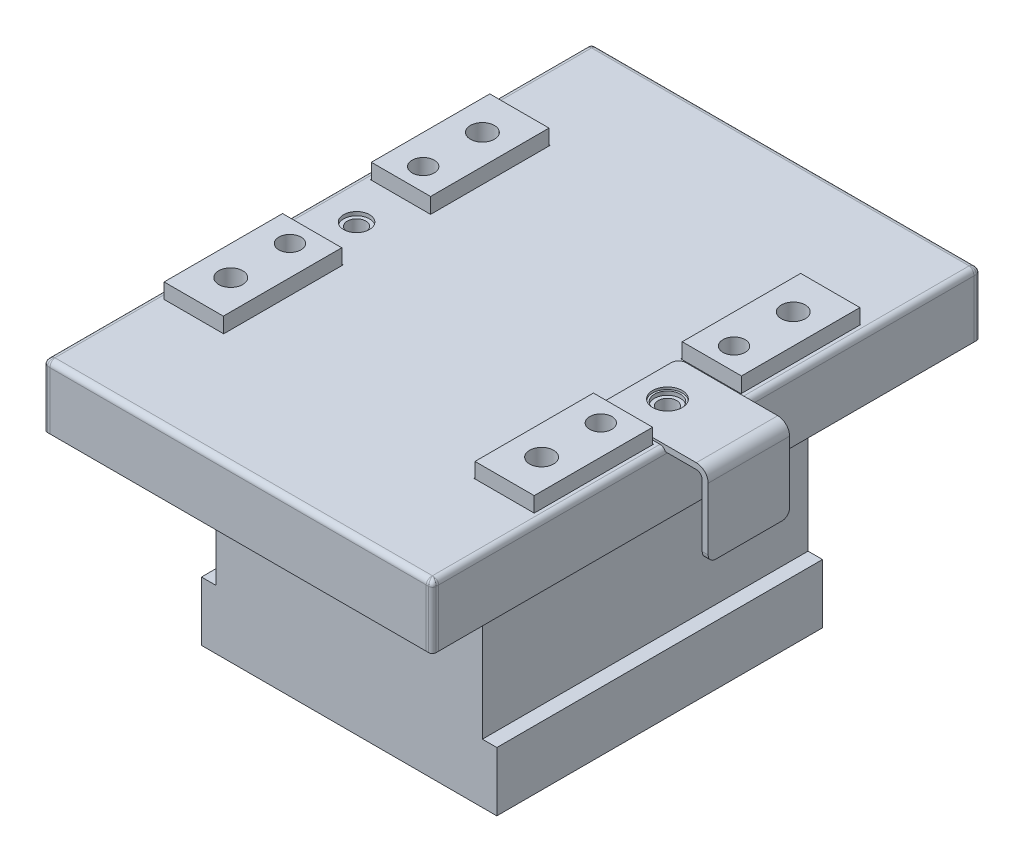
SolidWorks part; units mm, degrees
other "<上盖YTH5>-<焊接的边角7>"
ref_plane "前视" through (0, 0, 0) normal (0, 0, 1) x (1, 0, 0)
ref_plane "上视" through (0, 0, 0) normal (0, 1, 0) x (1, 0, 0)
ref_plane "右视" through (0, 0, 0) normal (1, 0, 0) x (0, 0, -1)
imported_body "输入1"
ref_plane "基准面1" through (-16.8713, 0, 0) normal (-1, 0, 0) x (0, 0, 1)
ref_plane "基准面2" through (0, 0, 46) normal (0, 0, 1) x (1, 0, 0)
hole_wizard "大小mm 暗销孔0" positions "草图2" profile "草图1" hole size "Ø3.0" standard "Gb"
sketch "草图2" plane through (0, 40.7273, 0) normal (0, 1, 0) x (1, 0, 0)
  circle A0 centre (4.1287, -55) radius 1.5 construction
  circle A1 centre (-37.8713, -37) radius 1.5 construction
  circle A2 centre (4.1287, -55) radius 1.5 construction
  circle A3 centre (-37.8713, -37) radius 1.5 construction
  point P0 (-37.8713, -55)
  point P2 (4.1287, -37)
  dimension "D3" = 42
  dimension "D4" = 42
  dimension "D1" = 18
  dimension "D2" = 18
sketch "草图1" plane through (-37.8713, 40.7273, 55) normal (1, 0, 0) x (0, 0, 1)
  line L0 (0, 0) -> (0, 10.0131)
  line L1 (0, 10.0131) -> (1.5, 10)
  line L2 (1.5, 10) -> (1.5, 0)
  line L5 (1.5, 0) -> (0, 0)
  line L10 (0, 10.0131) -> (-1.5, 10) construction
  line L11 (0, -6.35) -> (0, 107.95) construction
  dimension "孔直径" = 3
  dimension "孔深度" = 10
  dimension "导头角度" = 179
inserted part "上盖YTH5"
move or copy body "实体-移动/复制2" placed by mates yes
